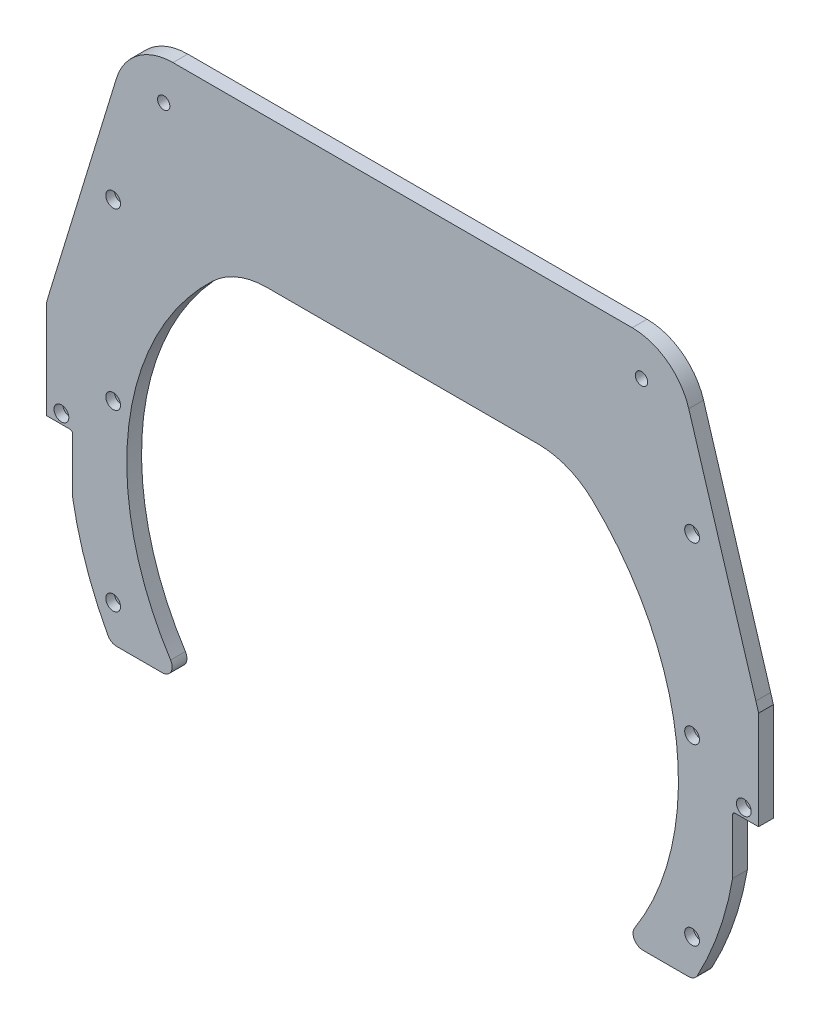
SolidWorks part; units mm, degrees
ref_plane "Front Plane" through (0, 0, 0) normal (0, 0, 1) x (1, 0, 0)
ref_plane "Top Plane" through (0, 0, 0) normal (0, 1, 0) x (1, 0, 0)
ref_plane "Right Plane" through (0, 0, 0) normal (1, 0, 0) x (0, 0, -1)
sketch "Sketch1" plane through (0, 0, 0) normal (0, 0, 1) x (1, 0, 0)
  line L5 (-254, 6.35) -> (254, 6.35) construction
  line L6 (0, 0) -> (0, 6.35) construction
  circle A0 centre (0, 0) radius 238.125
  dimension "D1" = 476.25
extrude "Boss-Extrude1" add sketch "Sketch1" along normal mid plane 9.525
sketch "Sketch5" plane through (0, 0, 4.7625) normal (0, 0, 1) x (1, 0, 0)
  line L0 (-66.9014, -158.75) -> (66.9014, -158.75)
  line L1 (-70.4249, -196.85) -> (70.4249, -196.85)
  line L2 (-87.4711, 142.875) -> (87.4711, 142.875)
  line L4 (238.1249, 0.254) -> (215.8999, 0.254)
  line L5 (-238.1249, 0.254) -> (-215.8999, 0.254)
  arc A0 (93.662, -151.13) -> (122.4595, 128.905) centre (0, 0) ccw
  circle A2 centre (0, 0) radius 238.125 construction
  arc A3 (93.662, -151.13) -> (66.9014, -158.75) centre (66.9014, -107.95) cw
  arc A4 (-66.9014, -158.75) -> (-93.662, -151.13) centre (-66.9014, -107.95) cw
  arc A5 (238.1249, 0.254) -> (154.7629, 180.975) centre (0, 0) ccw
  arc A6 (108.8385, -186.4591) -> (70.4249, -196.85) centre (70.4249, -120.65) cw
  arc A7 (-70.4249, -196.85) -> (-108.8385, -186.4591) centre (-70.4249, -120.65) cw
  arc A8 (-122.4595, 128.905) -> (-93.662, -151.13) centre (0, 0) ccw
  arc A9 (154.7629, 180.975) -> (-238.1249, 0.254) centre (0, 0) ccw
  arc A10 (215.8999, 0.254) -> (108.8385, -186.4591) centre (0, 0) cw
  arc A11 (-215.8999, 0.254) -> (-108.8385, -186.4591) centre (0, 0) ccw
  arc A12 (122.4595, 128.905) -> (87.4711, 142.875) centre (87.4711, 92.075) ccw
  arc A13 (-87.4711, 142.875) -> (-122.4595, 128.905) centre (-87.4711, 92.075) ccw
  circle A14 centre (0, 0) radius 238.125 construction
  point P15 (121.0668, -205.0521)
  point P18 (-121.0668, -205.0521)
  point P27 (-154.7629, 180.975)
  point P32 (-105.828, 142.875)
  dimension "D1" = 38.1
  dimension "D3" = 50.8
  dimension "D4" = 76.2
  dimension "D7" = 215.9
  dimension "D8" = 38.1
  dimension "D2" = 196.85
  dimension "D5" = 0.254
  dimension "D6" = 142.875
extrude "Cut-Extrude2" cut sketch "Sketch5" against normal through all flip side to cut
sketch "Sketch11" plane through (0, 0, -4.7625) normal (0, 0, -1) x (-1, 0, 0)
  line L0 (-188.1172, -105.9469) -> (-188.1172, -196.85)
  line L1 (188.1172, -105.9469) -> (-188.1172, -105.9469)
  line L2 (188.1172, -196.85) -> (-188.1172, -196.85)
  line L4 (188.1172, -105.9469) -> (188.1172, -196.85)
  line L5 (70.4249, -196.85) -> (-70.4249, -196.85) construction
  line L6 (86.8551, -136.3352) -> (0, 0) construction
  line L7 (0, 0) -> (0, 48.7192) construction
  arc A1 (108.8385, -186.4591) -> (215.8999, 0.254) centre (0, 0) ccw construction
  dimension "D1" = 105.9469
  dimension "D2" = 147.5
extrude "Cut-Extrude5" cut sketch "Sketch11" against normal through all
fillet "Fillet5" radius 6.35 4 edges at (188.1172, -105.9469, 0) (142.7869, -105.9469, 0) (-188.1172, -105.9469, 0) (-142.7869, -105.9469, 0)
sketch "Sketch14" plane through (0, 0, 4.7625) normal (0, 0, 1) x (1, 0, 0)
  line L0 (227.7201, 69.621) -> (176.2032, 238.125) construction
  line L1 (176.2032, 238.125) -> (0, 238.125) construction
  line L3 (0, 0) -> (0, 281.0829) construction
  line L4 (-176.2032, 238.125) -> (0, 238.125)
  line L5 (-227.7201, 69.621) -> (-176.2032, 238.125)
  arc A0 (238.1249, 0.254) -> (-238.1249, 0.254) centre (0, 0) ccw construction
  arc A1 (238.1249, 0.254) -> (-238.1249, 0.254) centre (0, 0) ccw construction
  arc A2 (227.7201, 69.621) -> (0, 238.125) centre (0, 0) ccw construction
  arc A3 (-227.7201, 69.621) -> (0, 238.125) centre (0, 0) cw
  dimension "D1" = 17
  dimension "D2" = 90
extrude "Boss-Extrude4" add sketch "Sketch14" against normal up to surface (9.525 mm away)
mirror "Mirror1" about plane through (0, 0, 0) normal (1, 0, 0) of "Boss-Extrude4"
fillet "Fillet3" radius 38.1 2 edges at (-176.2032, 238.125, 0) (176.2032, 238.125, 0)
hole_wizard "CBORE for #10 Socket Head Cap Screw1" positions "Sketch13" profile "Sketch12" counterbore size "#10" standard "ANSI Inch"
sketch "Sketch13" plane through (11.8922, 12.0597, 4.7625) normal (0, 0, -1) x (-1, 0, 0)
  line L0 (11.8922, -12.0597) -> (11.8922, 101.0673) construction
  point P1 (198.487, -94.6097)
  point P3 (198.487, 17.866)
  point P7 (198.487, 130.3417)
  point P21 (-174.7025, 130.3417)
  point P23 (-174.7025, 17.866)
  point P24 (-174.7025, -94.6097)
  point P25 (231.8245, -5.7097)
  point P27 (-208.04, -5.7097)
sketch "Sketch12" plane through (-186.5947, -82.55, 4.7625) normal (1, 0, 0) x (0, -1, 0)
  line L0 (0, 0) -> (0, 9.525)
  line L1 (0, 9.525) -> (2.8067, 9.525)
  line L3 (2.8067, 9.525) -> (2.8067, 5.588)
  line L4 (2.8067, 5.588) -> (4.7625, 5.588)
  line L5 (4.7625, 5.588) -> (4.7625, 0)
  line L7 (4.7625, 0) -> (0, 0)
  line L11 (0, -6.35) -> (0, 107.95) construction
  dimension "Thru Hole Dia." = 5.6134
  dimension "Thru Hole Depth" = 9.525
  dimension "C'Bore Dia." = 9.525
  dimension "C'Bore Depth" = 5.588
hole_wizard "3/8-16 Tapped Hole1" positions "Sketch17" profile "Sketch16" tap size "3/8-16" standard "ANSI Inch"
sketch "Sketch17" plane through (0, 0, 4.7625) normal (0, 0, 1) x (1, 0, 0)
  line L0 (-153.9875, 212.725) -> (153.9875, 212.725) construction
  line L2 (0, 0) -> (0, 212.725) construction
  point P0 (-153.9875, 212.725)
  point P1 (153.9875, 212.725)
  dimension "D1" = 212.725
  dimension "D2" = 307.975
sketch "Sketch16" plane through (-153.9875, 212.725, 4.7625) normal (1, 0, 0) x (0, -1, 0)
  line L0 (0, 0) -> (0, 34.1347)
  line L1 (0, 34.1347) -> (3.9687, 31.75)
  line L2 (3.9687, 31.75) -> (3.9687, 0)
  line L5 (3.9687, 0) -> (0, 0)
  line L10 (0, 34.1347) -> (-3.9688, 31.75) construction
  line L11 (0, -6.35) -> (0, 107.95) construction
  dimension "Tap Drill Dia." = 7.9375
  dimension "Tap Drill Depth" = 31.75
  dimension "Drill Angle" = 118
sketch "Sketch18" plane through (0, 0, 4.7625) normal (0, 0, 1) x (1, 0, 0)
  line L0 (0, 0) -> (0, 72.5762) construction
  line L1 (-229.4509, 0.254) -> (-212.725, 0.254)
  line L2 (-238.125, 63.6852) -> (-238.125, -36.8902)
  line L3 (-238.125, -36.8902) -> (-212.725, -36.8902)
  line L4 (-212.725, 0.254) -> (-212.725, -36.8902)
  line L5 (212.725, 0.254) -> (212.725, -36.8902)
  line L6 (238.125, -36.8902) -> (212.725, -36.8902)
  line L7 (238.125, 63.6852) -> (238.125, -36.8902)
  line L8 (238.125, 63.6852) -> (229.4509, 63.6852)
  line L9 (-229.4509, 0.254) -> (-229.4509, 63.6852)
  line L10 (-229.4509, 63.6852) -> (-238.125, 63.6852)
  line L11 (-238.1249, 0.254) -> (-215.8999, 0.254) construction
  line L12 (215.8999, 0.254) -> (238.1249, 0.254) construction
  line L13 (229.4509, 63.6852) -> (229.4509, 0.254)
  line L14 (229.4509, 0.254) -> (212.725, 0.254)
  arc A0 (-215.8999, 0.254) -> (-189.9552, -102.615) centre (0, 0) ccw construction
  arc A1 (-227.7201, 69.621) -> (-238.1249, 0.254) centre (0, 0) ccw construction
  dimension "D1" = 212.725
  dimension "D2" = 458.9018
extrude "Cut-Extrude6" cut sketch "Sketch18" against normal through all
fillet "Fillet7" radius 1.5875 2 edges at (-212.725, 0.254, 0) (212.725, 0.254, 0)
